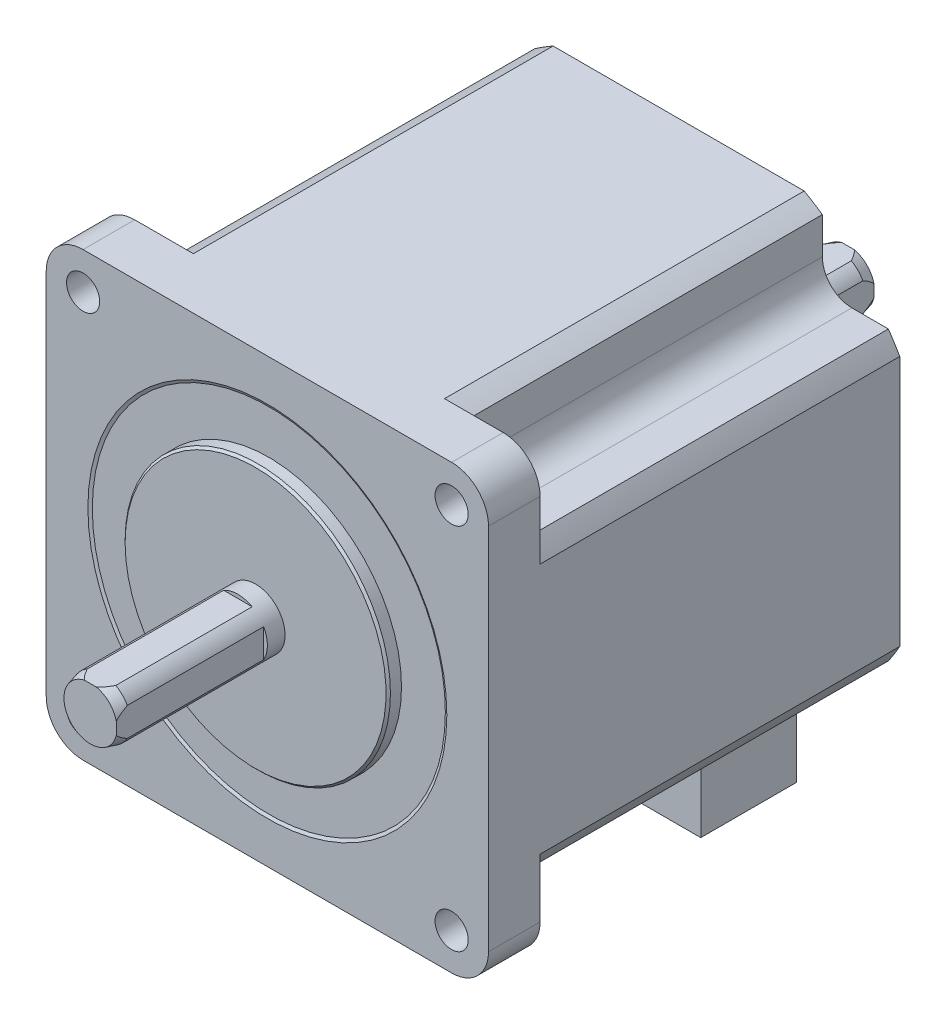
SolidWorks part; units mm, degrees
ref_plane "正面" through (0, 0, 0) normal (0, 0, 1) x (1, 0, 0)
ref_plane "平面" through (0, 0, 0) normal (0, 1, 0) x (1, 0, 0)
ref_plane "右側面" through (0, 0, 0) normal (1, 0, 0) x (0, 0, -1)
sketch "ｽｹｯﾁ1" plane through (0, 0, 0) normal (0, 0, 1) x (1, 0, 0)
  circle A0 centre (0, 0) radius 4
  dimension "D1" = 8
extrude "押し出し1" add sketch "ｽｹｯﾁ1" along normal blind 22.4
sketch "ｽｹｯﾁ2" plane through (0, 0, 0) normal (0, 0, -1) x (-1, 0, 0)
  circle A0 centre (0, 0) radius 18
  dimension "D1" = 36
extrude "押し出し2" add sketch "ｽｹｯﾁ2" along normal blind 1.6
sketch "ｽｹｯﾁ3" plane through (0, 0, -1.6) normal (0, 0, -1) x (-1, 0, 0)
  line L1 (-30, 30) -> (30, 30)
  line L2 (-30, 30) -> (-30, -30)
  line L3 (-30, -30) -> (30, -30)
  line L4 (30, 30) -> (30, -30)
  line L5 (-30, 30) -> (30, -30) construction
  line L6 (-30, -30) -> (30, 30) construction
  line L7 (25, 25) -> (-25, 25) construction
  line L8 (25, 25) -> (25, -25) construction
  line L9 (25, -25) -> (-25, -25) construction
  line L10 (-25, 25) -> (-25, -25) construction
  line L11 (25, 25) -> (-25, -25) construction
  line L12 (25, -25) -> (-25, 25) construction
  circle A0 centre (25, 25) radius 2.25
  circle A1 centre (-25, 25) radius 2.25
  circle A2 centre (25, -25) radius 2.25
  circle A3 centre (-25, -25) radius 2.25
  point P0 (0, 0)
  point P6 (0, 0)
  dimension "D3" = 50
  dimension "D4" = 50
  dimension "D6" = 4.5
  dimension "D1" = 60
  dimension "D2" = 60
extrude "押し出し3" add sketch "ｽｹｯﾁ3" along normal blind 7
fillet "Fillet1" radius 5 4 edges at (30, -30, -5.1) (-30, -30, -5.1) (-30, 30, -5.1) (30, 30, -5.1)
sketch "ｽｹｯﾁ4" plane through (0, 0, -8.6) normal (0, 0, -1) x (-1, 0, 0)
  line L0 (19.5, 19.5) -> (30, 19.5)
  line L1 (-19.5, 30) -> (19.5, 30)
  line L2 (-19.5, 30) -> (-19.5, 19.5)
  line L3 (-19.5, -30) -> (19.5, -30)
  line L4 (19.5, 30) -> (19.5, 19.5)
  line L5 (-19.5, 30) -> (19.5, -30) construction
  line L6 (-19.5, -30) -> (19.5, 30) construction
  line L7 (-30, 19.5) -> (-19.5, 19.5)
  line L8 (-30, 19.5) -> (-30, -19.5)
  line L9 (-30, -19.5) -> (-19.5, -19.5)
  line L10 (30, 19.5) -> (30, -19.5)
  line L11 (-30, 19.5) -> (30, -19.5) construction
  line L12 (-30, -19.5) -> (30, 19.5) construction
  line L13 (-19.5, -19.5) -> (-19.5, -30)
  line L14 (19.5, -19.5) -> (30, -19.5)
  line L15 (19.5, -19.5) -> (19.5, -30)
  circle A0 centre (0, 0) radius 34.5
  point P0 (0, 0)
  point P6 (0, 0)
  dimension "D5" = 69
  dimension "D1" = 39
  dimension "D2" = 60
  dimension "D3" = 60
  dimension "D4" = 39
extrude "押し出し4" add sketch "ｽｹｯﾁ4" along normal blind 48.8 contours L10 A0 L0 L4 L1 L2 L7 L8 L9 L13 L3 L15 L14
fillet "Fillet2" radius 4 4 edges at (19.5, -19.5, -33) (-19.5, -19.5, -33) (-19.5, 19.5, -33) (19.5, 19.5, -33)
sketch "Sketch1" plane through (0, -30, 0) normal (0, -1, 0) x (1, 0, 0)
  line L0 (17.0367, -57.4) -> (-17.0367, -57.4) construction
  line L1 (-16, -57.4) -> (16, -57.4)
  line L2 (-16, -57.4) -> (-16, -44.4)
  line L3 (-16, -44.4) -> (16, -44.4)
  line L4 (16, -57.4) -> (16, -44.4)
  dimension "D1" = 13
  dimension "D2" = 32
  dimension "D3" = 16
extrude "Extrude1" add sketch "Sketch1" along normal blind 10
chamfer "Chamfer1" distance 1.5 angle 15 1 edges at (4, 0, 22.4)
sketch "Sketch2" plane through (0, 0, 22.4) normal (0, 0, 1) x (1, 0, 0)
  line L1 (-4.7278, 5.1185) -> (3.4221, 5.1185)
  line L2 (-4.7278, 5.1185) -> (-4.7278, 3.5)
  line L3 (-4.7278, 3.5) -> (3.4221, 3.5)
  line L4 (3.4221, 5.1185) -> (3.4221, 3.5)
  line L5 (5.2412, 2.4413) -> (3.5, 2.4413)
  line L6 (5.2412, 2.4413) -> (5.2412, -4.2883)
  line L7 (5.2412, -4.2883) -> (3.5, -4.2883)
  line L8 (3.5, 2.4413) -> (3.5, -4.2883)
  dimension "D1" = 3.5
  dimension "D2" = 3.5
extrude "Extrude2" cut sketch "Sketch2" against normal blind 20
chamfer "Chamfer2" distance 0.3 angle 45 1 edges at (-18, 0, 0)
sketch "Sketch3" plane through (0, 0, -1.6) normal (0, 0, 1) x (1, 0, 0)
  circle A0 centre (0, 0) radius 18
  circle A1 centre (0, 0) radius 24.35
  dimension "D1" = 48.7
  dimension "D2" = 36
extrude "Extrude3" cut sketch "Sketch3" against normal blind 0.2
chamfer "Chamfer3" distance 0.2 distance2 0.4 1 edges at (24.35, 0, -1.8)
sketch "Sketch4" plane through (0, 0, -57.4) normal (0, 0, -1) x (-1, 0, 0)
  circle A0 centre (0, 0) radius 4
  dimension "D1" = 8
extrude "Extrude4" add sketch "Sketch4" along normal blind 23
sketch "Sketch5" plane through (0, 0, -80.4) normal (0, 0, -1) x (-1, 0, 0)
  line L1 (-2.9986, 5.5143) -> (3.3195, 5.5143)
  line L2 (-2.9986, 5.5143) -> (-2.9986, 3.5)
  line L3 (-2.9986, 3.5) -> (3.3195, 3.5)
  line L4 (3.3195, 5.5143) -> (3.3195, 3.5)
  line L5 (-5.554, 2.808) -> (-3.5, 2.808)
  line L6 (-5.554, 2.808) -> (-5.554, -3.231)
  line L7 (-5.554, -3.231) -> (-3.5, -3.231)
  line L8 (-3.5, 2.808) -> (-3.5, -3.231)
  dimension "D1" = 3.5
  dimension "D2" = 3.5
extrude "Extrude5" cut sketch "Sketch5" against normal blind 20
chamfer "Chamfer4" distance 1.5 angle 15 2 edges at (-2.8284, -2.8284, -80.4) (2.8284, 2.8284, -80.4)
